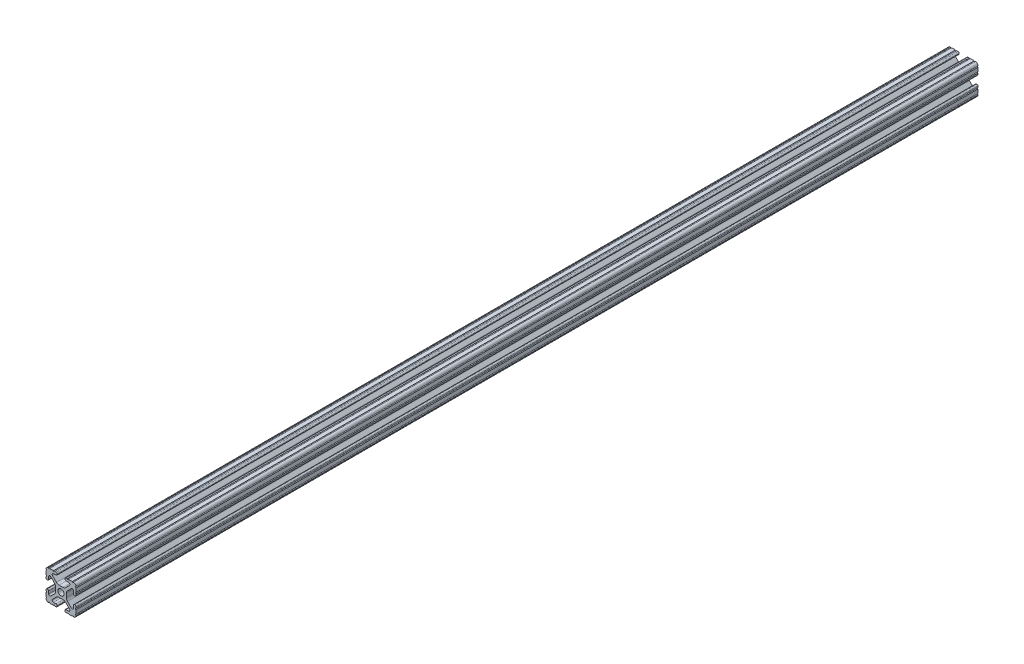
SolidWorks part; units mm, degrees
ref_plane "Front Plane" through (0, 0, 0) normal (0, 0, 1) x (1, 0, 0)
ref_plane "Top Plane" through (0, 0, 0) normal (0, 1, 0) x (1, 0, 0)
ref_plane "Right Plane" through (0, 0, 0) normal (1, 0, 0) x (0, 0, -1)
sketch "Sketch1" plane through (0, 0, 0) normal (0, 0, 1) x (1, 0, 0)
  line L0 (-7.207, 8.7244) -> (-3.8983, 5.4232)
  line L1 (-4.2875, 10.4902) -> (-6.4768, 10.4902)
  line L2 (-3.2385, 11.651) -> (-3.2385, 11.5392)
  line L3 (-5.3171, 12.7) -> (-4.2875, 12.7)
  line L4 (0, 13.4005) -> (0, -14.8534) construction
  line L5 (12.7, 0) -> (-13.9989, 0) construction
  line L6 (-9.5504, 12.7) -> (-6.3331, 12.7)
  line L7 (-12.7, 6.3331) -> (-12.7, 9.5504)
  line L8 (-12.7, 4.2875) -> (-12.7, 5.3171)
  line L9 (-11.5392, 3.2385) -> (-11.651, 3.2385)
  line L10 (-10.4902, 6.4021) -> (-10.4902, 4.2875)
  line L11 (-5.441, 3.8408) -> (-8.7371, 7.1294)
  line L12 (-4.5085, -1.5932) -> (-4.5085, 1.5932)
  line L13 (-1.7093, -4.4958) -> (1.7093, -4.4958)
  line L14 (3.9523, -5.4237) -> (7.1797, -8.6452)
  line L15 (6.4164, -10.4902) -> (4.2875, -10.4902)
  line L16 (3.2385, -11.5392) -> (3.2385, -11.651)
  line L17 (4.2875, -12.7) -> (5.3171, -12.7)
  line L18 (6.3331, -12.7) -> (9.5504, -12.7)
  line L19 (12.7, -9.5504) -> (12.7, -6.3331)
  line L20 (12.7, -5.3171) -> (12.7, -4.2875)
  line L21 (11.651, -3.2385) -> (11.5392, -3.2385)
  line L22 (10.4902, -4.2875) -> (10.4902, -6.4021)
  line L23 (8.7371, -7.1294) -> (5.441, -3.8408)
  line L24 (4.5085, -1.5932) -> (4.5085, 1.5932)
  line L25 (5.441, 3.8408) -> (8.7371, 7.1294)
  line L26 (10.4902, 6.4021) -> (10.4902, 4.2875)
  line L27 (11.5392, 3.2385) -> (11.651, 3.2385)
  line L28 (12.7, 4.2875) -> (12.7, 5.3171)
  line L29 (12.7, 6.3331) -> (12.7, 9.5504)
  line L30 (9.5504, 12.7) -> (6.3331, 12.7)
  line L31 (5.3171, 12.7) -> (4.2875, 12.7)
  line L32 (3.2385, 11.651) -> (3.2385, 11.5392)
  line L33 (4.2875, 10.4902) -> (6.4768, 10.4902)
  line L34 (7.207, 8.7244) -> (3.8983, 5.4232)
  line L35 (1.6558, 4.4958) -> (-1.6558, 4.4958)
  line L36 (-8.7371, -7.1294) -> (-5.441, -3.8408)
  line L37 (-10.4902, -4.2875) -> (-10.4902, -6.4021)
  line L38 (-11.651, -3.2385) -> (-11.5392, -3.2385)
  line L39 (-12.7, -5.3171) -> (-12.7, -4.2875)
  line L40 (-12.7, -9.5504) -> (-12.7, -6.3331)
  line L41 (-6.3331, -12.7) -> (-9.5504, -12.7)
  line L42 (-4.2875, -12.7) -> (-5.3171, -12.7)
  line L43 (-3.2385, -11.5392) -> (-3.2385, -11.651)
  line L44 (-6.4164, -10.4902) -> (-4.2875, -10.4902)
  line L45 (-3.9523, -5.4237) -> (-7.1797, -8.6452)
  arc A0 (-7.207, 8.7244) -> (-6.4768, 10.4902) centre (-6.4768, 9.4563) cw
  arc A1 (-3.2385, 11.5392) -> (-4.2875, 10.4902) centre (-4.2875, 11.5392) cw
  arc A2 (-4.2875, 12.7) -> (-3.2385, 11.651) centre (-4.2875, 11.651) cw
  arc A3 (-5.3171, 12.7) -> (-6.3331, 12.7) centre (-5.8251, 12.7) cw
  arc A4 (-9.5504, 12.7) -> (-10.5664, 12.6998) centre (-10.0584, 12.7) cw
  arc A5 (-12.6998, 10.5664) -> (-10.5664, 12.6998) centre (-10.5918, 10.5918) cw
  arc A6 (-12.6998, 10.5664) -> (-12.7, 9.5504) centre (-12.7, 10.0584) cw
  arc A7 (-12.7, 6.3331) -> (-12.7, 5.3171) centre (-12.7, 5.8251) cw
  arc A8 (-11.651, 3.2385) -> (-12.7, 4.2875) centre (-11.651, 4.2875) cw
  arc A9 (-10.4902, 4.2875) -> (-11.5392, 3.2385) centre (-11.5392, 4.2875) cw
  circle A10 centre (0, 0) radius 2.6035
  arc A11 (-10.4902, 6.4021) -> (-8.7371, 7.1294) centre (-9.4628, 6.4021) cw
  arc A12 (-5.441, 3.8408) -> (-4.5085, 1.5932) centre (-7.6835, 1.5932) cw
  arc A13 (-4.5085, -1.5932) -> (-5.441, -3.8408) centre (-7.6835, -1.5932) cw
  arc A14 (-8.7371, -7.1294) -> (-10.4902, -6.4021) centre (-9.4628, -6.4021) cw
  arc A15 (-1.7093, -4.4958) -> (-3.9523, -5.4237) centre (-1.7093, -7.6708) ccw
  arc A16 (3.9523, -5.4237) -> (1.7093, -4.4958) centre (1.7093, -7.6708) ccw
  arc A17 (6.4164, -10.4902) -> (7.1797, -8.6452) centre (6.4164, -9.4098) ccw
  arc A18 (4.2875, -10.4902) -> (3.2385, -11.5392) centre (4.2875, -11.5392) ccw
  arc A19 (3.2385, -11.651) -> (4.2875, -12.7) centre (4.2875, -11.651) ccw
  arc A20 (6.3331, -12.7) -> (5.3171, -12.7) centre (5.8251, -12.7) ccw
  arc A21 (10.5664, -12.6998) -> (9.5504, -12.7) centre (10.0584, -12.7) ccw
  arc A22 (10.5664, -12.6998) -> (12.6998, -10.5664) centre (10.5918, -10.5918) ccw
  arc A23 (12.7, -9.5504) -> (12.6998, -10.5664) centre (12.7, -10.0584) ccw
  arc A24 (12.7, -5.3171) -> (12.7, -6.3331) centre (12.7, -5.8251) ccw
  arc A25 (12.7, -4.2875) -> (11.651, -3.2385) centre (11.651, -4.2875) ccw
  arc A26 (11.5392, -3.2385) -> (10.4902, -4.2875) centre (11.5392, -4.2875) ccw
  arc A27 (8.7371, -7.1294) -> (10.4902, -6.4021) centre (9.4628, -6.4021) ccw
  arc A28 (4.5085, -1.5932) -> (5.441, -3.8408) centre (7.6835, -1.5932) ccw
  arc A29 (5.441, 3.8408) -> (4.5085, 1.5932) centre (7.6835, 1.5932) ccw
  arc A30 (10.4902, 6.4021) -> (8.7371, 7.1294) centre (9.4628, 6.4021) ccw
  arc A31 (10.4902, 4.2875) -> (11.5392, 3.2385) centre (11.5392, 4.2875) ccw
  arc A32 (11.651, 3.2385) -> (12.7, 4.2875) centre (11.651, 4.2875) ccw
  arc A33 (12.7, 6.3331) -> (12.7, 5.3171) centre (12.7, 5.8251) ccw
  arc A34 (12.6998, 10.5664) -> (12.7, 9.5504) centre (12.7, 10.0584) ccw
  arc A35 (12.6998, 10.5664) -> (10.5664, 12.6998) centre (10.5918, 10.5918) ccw
  arc A36 (9.5504, 12.7) -> (10.5664, 12.6998) centre (10.0584, 12.7) ccw
  arc A37 (5.3171, 12.7) -> (6.3331, 12.7) centre (5.8251, 12.7) ccw
  arc A38 (4.2875, 12.7) -> (3.2385, 11.651) centre (4.2875, 11.651) ccw
  arc A39 (3.2385, 11.5392) -> (4.2875, 10.4902) centre (4.2875, 11.5392) ccw
  arc A40 (7.207, 8.7244) -> (6.4768, 10.4902) centre (6.4768, 9.4563) ccw
  arc A41 (1.6558, 4.4958) -> (3.8983, 5.4232) centre (1.6558, 7.6708) ccw
  arc A42 (-1.6558, 4.4958) -> (-3.8983, 5.4232) centre (-1.6558, 7.6708) cw
  arc A43 (-11.5392, -3.2385) -> (-10.4902, -4.2875) centre (-11.5392, -4.2875) cw
  arc A44 (-12.7, -4.2875) -> (-11.651, -3.2385) centre (-11.651, -4.2875) cw
  arc A45 (-12.7, -5.3171) -> (-12.7, -6.3331) centre (-12.7, -5.8251) cw
  arc A46 (-12.7, -9.5504) -> (-12.6998, -10.5664) centre (-12.7, -10.0584) cw
  arc A47 (-10.5664, -12.6998) -> (-12.6998, -10.5664) centre (-10.5918, -10.5918) cw
  arc A48 (-10.5664, -12.6998) -> (-9.5504, -12.7) centre (-10.0584, -12.7) cw
  arc A49 (-6.3331, -12.7) -> (-5.3171, -12.7) centre (-5.8251, -12.7) cw
  arc A50 (-3.2385, -11.651) -> (-4.2875, -12.7) centre (-4.2875, -11.651) cw
  arc A51 (-4.2875, -10.4902) -> (-3.2385, -11.5392) centre (-4.2875, -11.5392) cw
  arc A52 (-6.4164, -10.4902) -> (-7.1797, -8.6452) centre (-6.4164, -9.4098) cw
  dimension "D1" = 5.207
  dimension "D9" = 14.859
  dimension "D2" = 25.4
  dimension "D3" = 12.7
  dimension "D4" = 6.477
  dimension "D5" = 8.2042
  dimension "D6" = 9.017
  dimension "D8" = 2.2098
  dimension "D10" = 2.2098
extrude "Extrude1" add sketch "Sketch1" against normal blind 762
